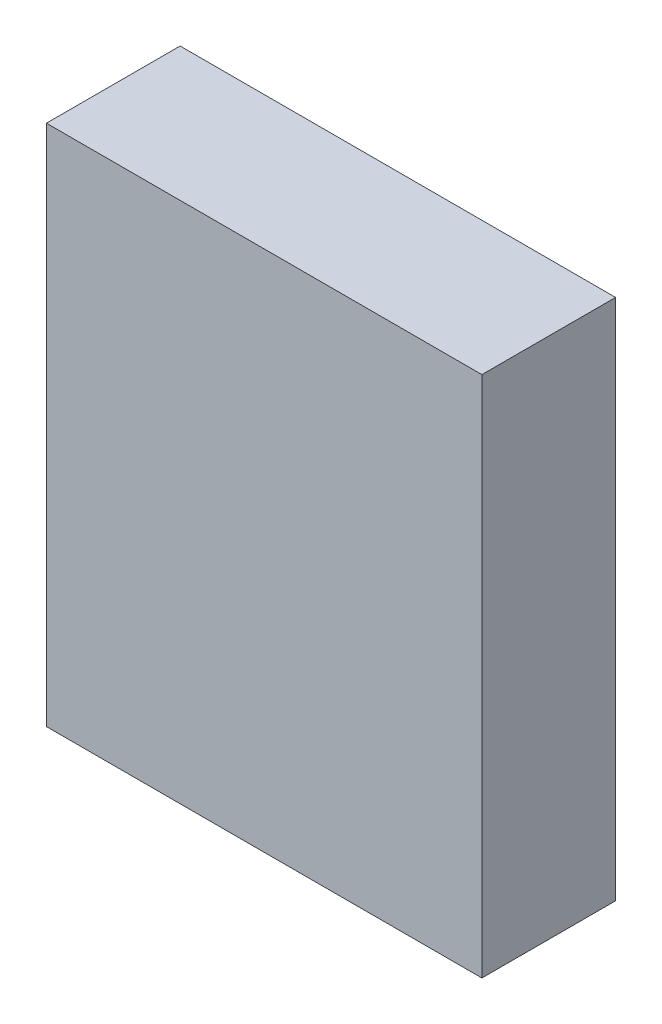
SolidWorks part; units mm, degrees
ref_plane "Front Plane" through (0, 0, 0) normal (1, 0, 0) x (0, 1, 0)
ref_plane "Top Plane" through (0, 0, 0) normal (0, 0, 1) x (0, 1, 0)
ref_plane "Right Plane" through (0, 0, 0) normal (0, 1, 0) x (-1, 0, 0)
sketch "Sketch1" plane through (0, 0, 0) normal (1, 0, 0) x (0, 1, 0)
  line L0 (-15.24, -7.7978) -> (15.24, -7.7978)
  line L1 (15.24, -7.7978) -> (15.24, 0)
  line L2 (15.24, 0) -> (-15.24, 0)
  line L3 (-15.24, 0) -> (-15.24, -7.7978)
extrude "Panel_or_block" add sketch "Sketch1" along normal blind 25.4
